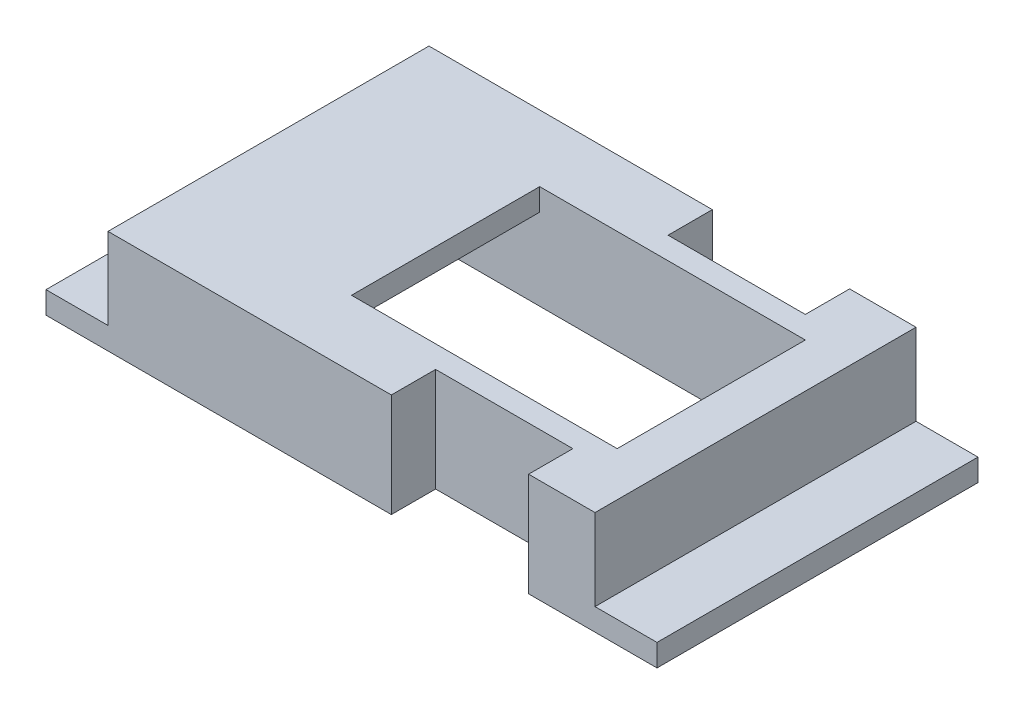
SolidWorks part; units mm, degrees
ref_plane "Plan de face" through (0, 0, 0) normal (0, 0, 1) x (1, 0, 0)
ref_plane "Plan de dessus" through (0, 0, 0) normal (0, 1, 0) x (1, 0, 0)
ref_plane "Plan de droite" through (0, 0, 0) normal (1, 0, 0) x (0, 0, -1)
sketch "Esquisse1" plane through (0, 0, 0) normal (0, 0, 1) x (1, 0, 0)
  line L3 (0, 19.8817) -> (20, 19.8817)
  line L5 (0, 16.2014) -> (-3.8, 16.2014)
  line L9 (20, 16.2014) -> (23.8, 16.2014)
  line L13 (20, 16.2014) -> (20, 19.8817)
  line L14 (0, 16.2014) -> (0, 19.8817)
  line L22 (-1, 17.2014) -> (-3.8, 17.2014)
  line L23 (-1, 17.2014) -> (-1, 20.8817)
  line L24 (-1, 20.8817) -> (21, 20.8817)
  line L25 (21, 17.2014) -> (21, 20.8817)
  line L26 (21, 17.2014) -> (23.8, 17.2014)
  line L30 (-1, 17.2014) -> (-3.8, 17.2014) construction
  line L31 (-3.8, 17.2014) -> (-3.8, 16.2014)
  line L32 (23.8, 17.2014) -> (23.8, 16.2014)
  point P7 (0, 15.2014)
  point P11 (20, 15.2014)
  dimension "D1" = 20
  dimension "D2" = 1
  dimension "D3" = 2.8
  dimension "D4" = 2.8
extrude "Boss.-Extru.1" add sketch "Esquisse1" along normal blind 10.5
sketch "Esquisse3" plane through (0, 19.8817, 0) normal (0, -1, 0) x (1, 0, 0)
  line L0 (0, 10.5) -> (20, 10.5) construction
  line L1 (0, 9.5) -> (20, 9.5)
  line L2 (0, 9.5) -> (0, 1)
  line L3 (0, 1) -> (20, 1)
  line L4 (20, 9.5) -> (20, 1)
  line L5 (0, 0) -> (20, 0) construction
  line L8 (0, 10.5) -> (0, 0) construction
  line L9 (20, 10.5) -> (20, 0) construction
  dimension "D1" = 1
  dimension "D2" = 1
extrude "Enlèv. mat.-Extru.1" cut sketch "Esquisse3" against normal blind 10
sketch "Esquisse4" plane through (0, 19.8817, 0) normal (0, -1, 0) x (1, 0, 0)
  line L0 (20, 0) -> (20, 1) construction
  line L1 (20, 1) -> (0, 1) construction
  line L2 (0, 1) -> (0, 0) construction
  line L3 (0, 0) -> (20, 0) construction
  line L4 (0, 10.5) -> (0, 9.5) construction
  line L5 (0, 9.5) -> (20, 9.5) construction
  line L6 (20, 9.5) -> (20, 10.5) construction
  line L7 (20, 10.5) -> (0, 10.5) construction
  line L8 (20, 0) -> (20, 1)
  line L9 (20, 1) -> (0, 1)
  line L10 (0, 1) -> (0, 0)
  line L11 (0, 0) -> (20, 0)
  line L12 (0, 10.5) -> (0, 9.5)
  line L13 (0, 9.5) -> (20, 9.5)
  line L14 (20, 9.5) -> (20, 10.5)
  line L15 (20, 10.5) -> (0, 10.5)
extrude "Boss.-Extru.2" add sketch "Esquisse4" along normal up to surface (3.6803 mm away)
sketch "Esquisse14" plane through (0, 0, 10.5) normal (0, 0, 1) x (1, 0, 0)
  line L8 (-3.8, 16.2014) -> (23.8, 16.2014)
  line L9 (23.8, 16.2014) -> (23.8, 17.2014)
  line L10 (23.8, 17.2014) -> (21, 17.2014)
  line L11 (21, 17.2014) -> (21, 20.8817)
  line L12 (21, 20.8817) -> (-1, 20.8817)
  line L13 (-1, 20.8817) -> (-1, 17.2014)
  line L14 (-1, 17.2014) -> (-3.8, 17.2014)
  line L15 (-3.8, 17.2014) -> (-3.8, 16.2014)
  line L16 (-3.8, 16.2014) -> (23.8, 16.2014)
  line L17 (23.8, 16.2014) -> (23.8, 17.2014)
  line L18 (23.8, 17.2014) -> (21, 17.2014)
  line L19 (21, 17.2014) -> (21, 20.8817)
  line L20 (21, 20.8817) -> (-1, 20.8817)
  line L21 (-1, 20.8817) -> (-1, 17.2014)
  line L22 (-1, 17.2014) -> (-3.8, 17.2014)
  line L23 (-3.8, 17.2014) -> (-3.8, 16.2014)
  dimension "D1" = 0
extrude "Boss.-Extru.8" add sketch "Esquisse14" along normal blind 2
sketch "Esquisse15" plane through (0, 0, 0) normal (0, 0, -1) x (-1, 0, 0)
  line L8 (1, 17.2014) -> (1, 20.8817)
  line L9 (1, 20.8817) -> (-21, 20.8817)
  line L10 (-21, 20.8817) -> (-21, 17.2014)
  line L11 (-21, 17.2014) -> (-23.8, 17.2014)
  line L12 (-23.8, 17.2014) -> (-23.8, 16.2014)
  line L13 (-23.8, 16.2014) -> (3.8, 16.2014)
  line L14 (3.8, 16.2014) -> (3.8, 17.2014)
  line L15 (3.8, 17.2014) -> (1, 17.2014)
  line L16 (1, 17.2014) -> (1, 20.8817)
  line L17 (1, 20.8817) -> (-21, 20.8817)
  line L18 (-21, 20.8817) -> (-21, 17.2014)
  line L19 (-21, 17.2014) -> (-23.8, 17.2014)
  line L20 (-23.8, 17.2014) -> (-23.8, 16.2014)
  line L21 (-23.8, 16.2014) -> (3.8, 16.2014)
  line L22 (3.8, 16.2014) -> (3.8, 17.2014)
  line L23 (3.8, 17.2014) -> (1, 17.2014)
  dimension "D1" = 0
extrude "Boss.-Extru.9" add sketch "Esquisse15" along normal blind 2
sketch "Esquisse5" plane through (0, 0, 0) normal (1, 0, 0) x (0, 0, -1)
  line L0 (-1, 20.8817) -> (-1, 16.2014) construction
  line L1 (-9.5, 20.8817) -> (-1, 20.8817)
  line L2 (-9.5, 20.8817) -> (-9.5, 19.8817)
  line L3 (-9.5, 19.8817) -> (-1, 19.8817)
  line L4 (-1, 20.8817) -> (-1, 19.8817)
  dimension "D1" = 1
extrude "Boss.-Extru.3" add sketch "Esquisse5" along normal blind 7
sketch "Esquisse6" plane through (20, 0, 0) normal (-1, 0, 0) x (0, 0, 1)
  line L0 (9.5, 20.8817) -> (9.5, 16.2014) construction
  line L1 (1, 20.8817) -> (9.5, 20.8817)
  line L2 (1, 20.8817) -> (1, 19.8817)
  line L3 (1, 19.8817) -> (9.5, 19.8817)
  line L4 (9.5, 20.8817) -> (9.5, 19.8817)
  dimension "D1" = 1
extrude "Boss.-Extru.4" add sketch "Esquisse6" along normal blind 1
sketch "Esquisse23" plane through (0, 0, 12.5) normal (0, 0, 1) x (1, 0, 0)
  line L0 (21, 20.8817) -> (-1, 20.8817) construction
  line L1 (11.8, 20.8817) -> (18, 20.8817)
  line L2 (11.8, 20.8817) -> (11.8, 16.2014)
  line L3 (11.8, 16.2014) -> (18, 16.2014)
  line L4 (18, 20.8817) -> (18, 16.2014)
  line L5 (-3.8, 16.2014) -> (23.8, 16.2014) construction
  line L6 (21, 17.2014) -> (21, 20.8817) construction
  dimension "D1" = 6.2
  dimension "D2" = 3
extrude "Enlèv. mat.-Extru.2" cut sketch "Esquisse23" against normal blind 2
sketch "Esquisse24" plane through (0, 0, -2) normal (0, 0, -1) x (-1, 0, 0)
  line L0 (1, 20.8817) -> (-21, 20.8817) construction
  line L1 (-18, 20.8817) -> (-11.8, 20.8817)
  line L2 (-18, 20.8817) -> (-18, 16.2014)
  line L3 (-18, 16.2014) -> (-11.8, 16.2014)
  line L4 (-11.8, 20.8817) -> (-11.8, 16.2014)
  line L5 (-23.8, 16.2014) -> (3.8, 16.2014) construction
  line L6 (-21, 20.8817) -> (-21, 17.2014) construction
  dimension "D1" = 3
  dimension "D2" = 6.2
extrude "Enlèv. mat.-Extru.3" cut sketch "Esquisse24" against normal blind 2
